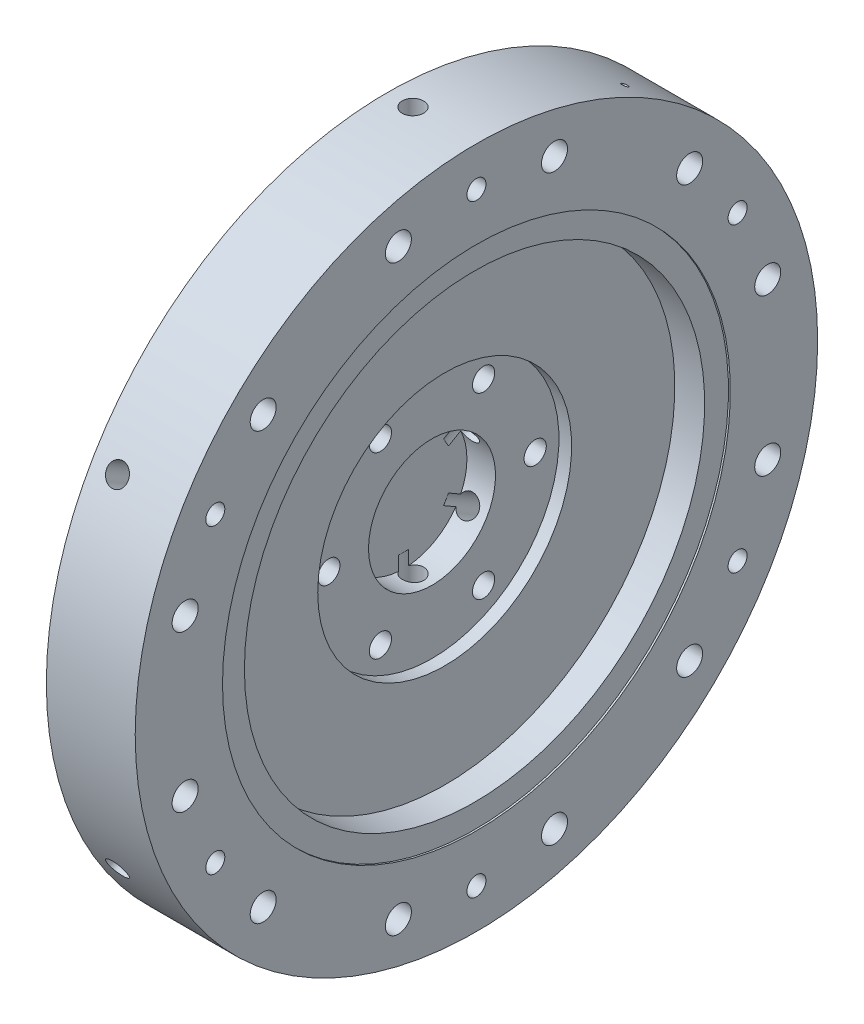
SolidWorks part; units mm, degrees
ref_plane "Face" through (0, 0, 0) normal (0, 0, 1) x (1, 0, 0)
ref_plane "Dessus" through (0, 0, 0) normal (0, 1, 0) x (1, 0, 0)
ref_plane "Droite" through (0, 0, 0) normal (1, 0, 0) x (0, 0, -1)
sketch "Esquisse1" plane through (0, 0, 0) normal (0, 0, 1) x (1, 0, 0)
  line L0 (0, 0) -> (65.9322, 0) construction
  line L1 (0, 0) -> (0, 107.5)
  line L2 (0, 107.5) -> (28, 107.5)
  line L3 (28, 107.5) -> (28, 80)
  line L4 (28, 80) -> (27.4, 80)
  line L5 (27.4, 80) -> (27.4, 72.5)
  line L6 (27.4, 72.5) -> (18, 72.5)
  line L7 (18, 72.5) -> (18, 40)
  line L8 (18, 40) -> (14, 40)
  line L9 (14, 40) -> (14, 20)
  line L10 (14, 20) -> (5, 20)
  line L11 (5, 20) -> (5, 0)
  line L12 (0, 0) -> (5, 0)
  dimension "D1" = 215
  dimension "D2" = 160
  dimension "D3" = 145
  dimension "D4" = 80
  dimension "D5" = 40
  dimension "D6" = 0.6
  dimension "D7" = 10
  dimension "D8" = 14
  dimension "D9" = 23
  dimension "D10" = 28
revolve "Révolution1" add sketch "Esquisse1" angle 360 about L0
sketch "Esquisse2" plane through (0, 0, 0) normal (-1, 0, 0) x (0, 0, 1)
  line L0 (0, 0) -> (0, 134.505) construction
  line L1 (0, 0) -> (-31.0694, 53.8137) construction
  line L2 (0, 0) -> (-32.374, 120.8213) construction
  dimension "D1" = 30
  dimension "D2" = 15
hole_wizard "Chambrage pour vis à tête hexagonale M81" positions "Esquisse4" profile "Esquisse3" counterbore size "M8" standard "ISO"
sketch "Esquisse4" plane through (0, 0, 0) normal (-1, 0, 0) x (0, 0, 1)
  line L1 (0, 0) -> (-32.374, 120.8213) construction
  circle A0 centre (0, 0) radius 107.5 construction
  point P0 (-24.5878, 91.763)
  dimension "D1" = 95
sketch "Esquisse3" plane through (0, 91.763, -24.5878) normal (0, 1, 0) x (0, 0, 1)
  line L0 (0, 0) -> (0, 28)
  line L1 (0, 28) -> (4.1, 28)
  line L3 (4.1, 28) -> (4.1, 8)
  line L4 (4.1, 8) -> (7.5, 8)
  line L5 (7.5, 8) -> (7.5, 0)
  line L7 (7.5, 0) -> (0, 0)
  line L11 (0, -6.35) -> (0, 107.95) construction
  dimension "Diamètre du perçage jusqu'au prochain" = 8.2
  dimension "Profondeur du perçage jusqu'au prochain" = 28
  dimension "Diamètre du chambrage" = 15
  dimension "Profondeur du chambrage" = 8
pattern_circular "Répétition circulaire1" count 12 every 30 about axis through (0, 0, 0) along (1, 0, 0) of "Chambrage pour vis à tête hexagonale M81"
hole_wizard "Chambrage pour vis à tête hexagonale M61" positions "Esquisse6" profile "Esquisse5" counterbore size "M6" standard "ISO"
sketch "Esquisse6" plane through (0, 0, 0) normal (-1, 0, 0) x (0, 0, 1)
  line L0 (0, 0) -> (-31.0694, 53.8137) construction
  circle A0 centre (0, 0) radius 107.5 construction
  point P0 (16.25, -28.1458)
  dimension "D1" = 32.5
sketch "Esquisse5" plane through (0, -28.1458, 16.25) normal (0, 1, 0) x (0, 0, 1)
  line L0 (0, 0) -> (0, 28)
  line L1 (0, 28) -> (3.5, 28)
  line L3 (3.5, 28) -> (3.5, 6)
  line L4 (3.5, 6) -> (5.5, 6)
  line L5 (5.5, 6) -> (5.5, 0)
  line L7 (5.5, 0) -> (0, 0)
  line L11 (0, -6.35) -> (0, 107.95) construction
  dimension "Diamètre du perçage jusqu'au prochain" = 7
  dimension "Profondeur du perçage jusqu'au prochain" = 28
  dimension "Diamètre du chambrage" = 11
  dimension "Profondeur du chambrage" = 6
pattern_circular "Répétition circulaire2" count 6 every 60 about axis through (0, 0, 0) along (1, 0, 0) of "Chambrage pour vis à tête hexagonale M61"
ref_plane "Plan1" through (0, 107.5, 0) normal (0, 1, 0) x (-1, 0, 0)
sketch "Esquisse7" plane through (0, 107.5, 0) normal (0, 1, 0) x (-1, 0, 0)
  line L0 (0, 0) -> (-65.9322, 0) construction
  line L1 (-28, 107.5) -> (-28, -107.5) construction
  circle A0 centre (-8, 0) radius 3.375
  dimension "D1" = 20
  dimension "D2" = 6.75
extrude "Enlèv. mat.-Extru.2" cut sketch "Esquisse7" against normal blind 92
sketch "Esquisse8" plane through (18, 0, 0) normal (1, 0, 0) x (0, 0, -1)
  line L0 (0, 0) -> (0, 134.505) construction
  circle A0 centre (0, 95) radius 3
  circle A1 centre (0, 0) radius 107.5 construction
  dimension "D1" = 95
  dimension "D2" = 6
extrude "Enlèv. mat.-Extru.4" cut sketch "Esquisse8" against normal blind 10 and the other way blind 12
pattern_circular "Répétition circulaire3" count 6 every 60 about axis through (0, 0, 0) along (1, 0, 0) of "Enlèv. mat.-Extru.2", "Enlèv. mat.-Extru.4"
ref_plane "Plan2" through (0, 0, 0) normal (0, -0.866, 0.5) x (1, 0, 0)
ref_plane "Plan3" through (0, 93.0977, -53.75) normal (0, -0.866, 0.5) x (1, 0, 0)
sketch "Esquisse9" plane through (0, 93.0977, -53.75) normal (0, -0.866, 0.5) x (1, 0, 0)
  line L0 (0, 0) -> (65.9322, 0) construction
  line L1 (28, -107.5) -> (28, 107.5) construction
  circle A0 centre (21, 0) radius 1
  dimension "D1" = 2
  dimension "D2" = 7
extrude "Enlèv. mat.-Extru.5" cut sketch "Esquisse9" along normal blind 37
